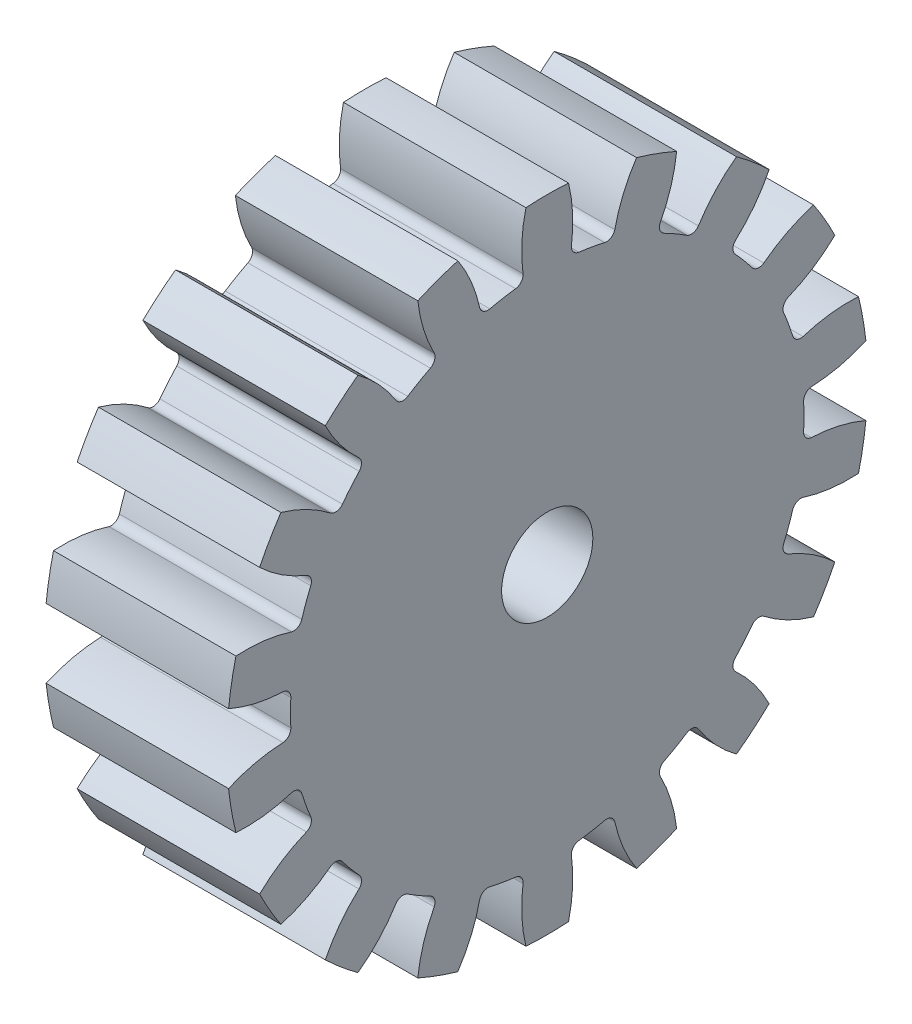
SolidWorks part; units mm, degrees
ref_plane "Front" through (0, 0, 0) normal (0, 0, 1) x (1, 0, 0)
ref_plane "Top" through (0, 0, 0) normal (0, 1, 0) x (1, 0, 0)
ref_plane "Right" through (0, 0, 0) normal (1, 0, 0) x (0, 0, -1)
ref_plane "Plane1" through (-5.0626, 0, 0) normal (-1, 0, 0) x (0, -1, 0)
sketch "Sketch1" plane through (-5.0626, 0, 0) normal (-1, 0, 0) x (0, -1, 0)
  circle A0 centre (0, 0) radius 1.5
  arc A1 (-5.0904, -6.7361) -> (-5.0304, -7.1217) centre (-5.2596, -6.9599) cw
  arc A2 (-5.8657, -8.7582) -> (-5.0304, -7.1217) centre (-1.1103, -10.154) cw
  arc A3 (-5.8657, -8.7582) -> (-4.652, -9.459) centre (0, 0) ccw
  arc A4 (-3.6524, -7.9173) -> (-4.652, -9.459) centre (-8.2191, -6.0511) cw
  arc A5 (-3.6524, -7.9173) -> (-3.2884, -7.7765) centre (-3.3976, -8.0348) cw
  arc A6 (-3.2884, -7.7765) -> (-2.4796, -8.0709) centre (0, 0) ccw
  arc A7 (-2.4796, -8.0709) -> (-2.2913, -8.4127) centre (-2.562, -8.339) cw
  arc A8 (-2.5165, -10.2362) -> (-2.2913, -8.4127) centre (2.4295, -9.9214) cw
  arc A9 (-2.5165, -10.2362) -> (-1.1363, -10.4796) centre (0, 0) ccw
  arc A10 (-0.7242, -8.689) -> (-1.1363, -10.4796) centre (-5.6538, -8.4973) cw
  arc A11 (-0.7242, -8.689) -> (-0.4304, -8.4322) centre (-0.4447, -8.7123) cw
  arc A12 (-0.4304, -8.4322) -> (0.4304, -8.4322) centre (0, 0) ccw
  arc A13 (0.4304, -8.4322) -> (0.7242, -8.689) centre (0.4447, -8.7123) cw
  arc A14 (1.1363, -10.4796) -> (0.7242, -8.689) centre (5.6763, -8.4921) cw
  arc A15 (1.1363, -10.4796) -> (2.5165, -10.2362) centre (0, 0) ccw
  arc A16 (2.2913, -8.4127) -> (2.5165, -10.2362) centre (-2.4066, -9.9185) cw
  arc A17 (2.2913, -8.4127) -> (2.4796, -8.0709) centre (2.562, -8.339) cw
  arc A18 (2.4796, -8.0709) -> (3.2884, -7.7765) centre (0, 0) ccw
  arc A19 (3.2884, -7.7765) -> (3.6524, -7.9173) centre (3.3976, -8.0348) cw
  arc A20 (4.652, -9.459) -> (3.6524, -7.9173) centre (8.2384, -6.0386) cw
  arc A21 (4.652, -9.459) -> (5.8657, -8.7582) centre (0, 0) ccw
  arc A22 (5.0304, -7.1217) -> (5.8657, -8.7582) centre (1.1309, -10.1435) cw
  arc A23 (5.0304, -7.1217) -> (5.0904, -6.7361) centre (5.2596, -6.9599) cw
  arc A24 (5.0904, -6.7361) -> (5.7498, -6.1828) centre (0, 0) ccw
  arc A25 (5.7498, -6.1828) -> (6.14, -6.1907) centre (5.9408, -6.3882) cw
  arc A26 (7.6066, -7.2974) -> (6.14, -6.1907) centre (9.8069, -2.8567) cw
  arc A27 (7.6066, -7.2974) -> (8.5075, -6.2238) centre (0, 0) ccw
  arc A28 (7.1628, -4.9717) -> (8.5075, -6.2238) centre (4.5319, -9.145) cw
  arc A29 (7.1628, -4.9717) -> (7.0873, -4.5888) centre (7.3228, -4.7413) cw
  arc A30 (7.0873, -4.5888) -> (7.5177, -3.8434) centre (0, 0) ccw
  arc A31 (7.5177, -3.8434) -> (7.887, -3.7173) centre (7.7674, -3.9711) cw
  arc A32 (9.6437, -4.2558) -> (7.887, -3.7173) centre (10.1925, 0.6698) cw
  arc A33 (9.6437, -4.2558) -> (10.1231, -2.9388) centre (0, 0) ccw
  arc A34 (8.4313, -2.222) -> (10.1231, -2.9388) centre (7.3864, -7.0435) cw
  arc A35 (8.4313, -2.222) -> (8.2294, -1.8881) centre (8.5028, -1.9508) cw
  arc A36 (8.2294, -1.8881) -> (8.3788, -1.0404) centre (0, 0) ccw
  arc A37 (8.3788, -1.0404) -> (8.6828, -0.7956) centre (8.6572, -1.075) cw
  arc A38 (10.5177, -0.7008) -> (8.6828, -0.7956) centre (9.3488, 4.1154) cw
  arc A39 (10.5177, -0.7008) -> (10.5177, 0.7008) centre (0, 0) ccw
  arc A40 (8.6828, 0.7956) -> (10.5177, 0.7008) centre (9.35, -4.0924) cw
  arc A41 (8.6828, 0.7956) -> (8.3788, 1.0404) centre (8.6572, 1.075) cw
  arc A42 (8.3788, 1.0404) -> (8.2294, 1.8881) centre (0, 0) ccw
  arc A43 (8.2294, 1.8881) -> (8.4313, 2.222) centre (8.5028, 1.9508) cw
  arc A44 (10.1231, 2.9388) -> (8.4313, 2.222) centre (7.3774, 7.0647) cw
  arc A45 (10.1231, 2.9388) -> (9.6437, 4.2558) centre (0, 0) ccw
  arc A46 (7.887, 3.7173) -> (9.6437, 4.2558) centre (10.1858, -0.6477) cw
  arc A47 (7.887, 3.7173) -> (7.5177, 3.8434) centre (7.7674, 3.9711) cw
  arc A48 (7.5177, 3.8434) -> (7.0873, 4.5888) centre (0, 0) ccw
  arc A49 (7.0873, 4.5888) -> (7.1628, 4.9717) centre (7.3228, 4.7413) cw
  arc A50 (8.5075, 6.2238) -> (7.1628, 4.9717) centre (4.5162, 9.1619) cw
  arc A51 (8.5075, 6.2238) -> (7.6066, 7.2974) centre (0, 0) ccw
  arc A52 (6.14, 6.1907) -> (7.6066, 7.2974) centre (9.793, 2.8751) cw
  arc A53 (6.14, 6.1907) -> (5.7498, 6.1828) centre (5.9408, 6.3882) cw
  arc A54 (5.7498, 6.1828) -> (5.0904, 6.7361) centre (0, 0) ccw
  arc A55 (5.0904, 6.7361) -> (5.0304, 7.1217) centre (5.2596, 6.9599) cw
  arc A56 (5.8657, 8.7582) -> (5.0304, 7.1217) centre (1.1103, 10.154) cw
  arc A57 (5.8657, 8.7582) -> (4.652, 9.459) centre (0, 0) ccw
  arc A58 (3.6524, 7.9173) -> (4.652, 9.459) centre (8.2191, 6.0511) cw
  arc A59 (3.6524, 7.9173) -> (3.2884, 7.7765) centre (3.3976, 8.0348) cw
  arc A60 (3.2884, 7.7765) -> (2.4796, 8.0709) centre (0, 0) ccw
  arc A61 (2.4796, 8.0709) -> (2.2913, 8.4127) centre (2.562, 8.339) cw
  arc A62 (2.5165, 10.2362) -> (2.2913, 8.4127) centre (-2.4295, 9.9214) cw
  arc A63 (2.5165, 10.2362) -> (1.1363, 10.4796) centre (0, 0) ccw
  arc A64 (0.7242, 8.689) -> (1.1363, 10.4796) centre (5.6538, 8.4973) cw
  arc A65 (0.7242, 8.689) -> (0.4304, 8.4322) centre (0.4447, 8.7123) cw
  arc A66 (0.4304, 8.4322) -> (-0.4304, 8.4322) centre (0, 0) ccw
  arc A67 (-0.4304, 8.4322) -> (-0.7242, 8.689) centre (-0.4447, 8.7123) cw
  arc A68 (-1.1363, 10.4796) -> (-0.7242, 8.689) centre (-5.6763, 8.4921) cw
  arc A69 (-1.1363, 10.4796) -> (-2.5165, 10.2362) centre (0, 0) ccw
  arc A70 (-2.2913, 8.4127) -> (-2.5165, 10.2362) centre (2.4066, 9.9185) cw
  arc A71 (-2.2913, 8.4127) -> (-2.4796, 8.0709) centre (-2.562, 8.339) cw
  arc A72 (-2.4796, 8.0709) -> (-3.2884, 7.7765) centre (0, 0) ccw
  arc A73 (-3.2884, 7.7765) -> (-3.6524, 7.9173) centre (-3.3976, 8.0348) cw
  arc A74 (-4.652, 9.459) -> (-3.6524, 7.9173) centre (-8.2384, 6.0386) cw
  arc A75 (-4.652, 9.459) -> (-5.8657, 8.7582) centre (0, 0) ccw
  arc A76 (-5.0304, 7.1217) -> (-5.8657, 8.7582) centre (-1.1309, 10.1435) cw
  arc A77 (-5.0304, 7.1217) -> (-5.0904, 6.7361) centre (-5.2596, 6.9599) cw
  arc A78 (-5.0904, 6.7361) -> (-5.7498, 6.1828) centre (0, 0) ccw
  arc A79 (-5.7498, 6.1828) -> (-6.14, 6.1907) centre (-5.9408, 6.3882) cw
  arc A80 (-7.6066, 7.2974) -> (-6.14, 6.1907) centre (-9.8069, 2.8567) cw
  arc A81 (-7.6066, 7.2974) -> (-8.5075, 6.2238) centre (0, 0) ccw
  arc A82 (-7.1628, 4.9717) -> (-8.5075, 6.2238) centre (-4.5319, 9.145) cw
  arc A83 (-7.1628, 4.9717) -> (-7.0873, 4.5888) centre (-7.3228, 4.7413) cw
  arc A84 (-7.0873, 4.5888) -> (-7.5177, 3.8434) centre (0, 0) ccw
  arc A85 (-7.5177, 3.8434) -> (-7.887, 3.7173) centre (-7.7674, 3.9711) cw
  arc A86 (-9.6437, 4.2558) -> (-7.887, 3.7173) centre (-10.1925, -0.6698) cw
  arc A87 (-9.6437, 4.2558) -> (-10.1231, 2.9388) centre (0, 0) ccw
  arc A88 (-8.4313, 2.222) -> (-10.1231, 2.9388) centre (-7.3864, 7.0435) cw
  arc A89 (-8.4313, 2.222) -> (-8.2294, 1.8881) centre (-8.5028, 1.9508) cw
  arc A90 (-8.2294, 1.8881) -> (-8.3788, 1.0404) centre (0, 0) ccw
  arc A91 (-8.3788, 1.0404) -> (-8.6828, 0.7956) centre (-8.6572, 1.075) cw
  arc A92 (-10.5177, 0.7008) -> (-8.6828, 0.7956) centre (-9.3488, -4.1154) cw
  arc A93 (-10.5177, 0.7008) -> (-10.5177, -0.7008) centre (0, 0) ccw
  arc A94 (-8.6828, -0.7956) -> (-10.5177, -0.7008) centre (-9.35, 4.0924) cw
  arc A95 (-8.6828, -0.7956) -> (-8.3788, -1.0404) centre (-8.6572, -1.075) cw
  arc A96 (-8.3788, -1.0404) -> (-8.2294, -1.8881) centre (0, 0) ccw
  arc A97 (-8.2294, -1.8881) -> (-8.4313, -2.222) centre (-8.5028, -1.9508) cw
  arc A98 (-10.1231, -2.9388) -> (-8.4313, -2.222) centre (-7.3774, -7.0647) cw
  arc A99 (-10.1231, -2.9388) -> (-9.6437, -4.2558) centre (0, 0) ccw
  arc A100 (-7.887, -3.7173) -> (-9.6437, -4.2558) centre (-10.1858, 0.6477) cw
  arc A101 (-7.887, -3.7173) -> (-7.5177, -3.8434) centre (-7.7674, -3.9711) cw
  arc A102 (-7.5177, -3.8434) -> (-7.0873, -4.5888) centre (0, 0) ccw
  arc A103 (-7.0873, -4.5888) -> (-7.1628, -4.9717) centre (-7.3228, -4.7413) cw
  arc A104 (-8.5075, -6.2238) -> (-7.1628, -4.9717) centre (-4.5162, -9.1619) cw
  arc A105 (-8.5075, -6.2238) -> (-7.6066, -7.2974) centre (0, 0) ccw
  arc A106 (-6.14, -6.1907) -> (-7.6066, -7.2974) centre (-9.793, -2.8751) cw
  arc A107 (-6.14, -6.1907) -> (-5.7498, -6.1828) centre (-5.9408, -6.3882) cw
  arc A108 (-5.7498, -6.1828) -> (-5.0904, -6.7361) centre (0, 0) ccw
extrude "Boss-Extrude1" add sketch "Sketch1" against normal blind 6
